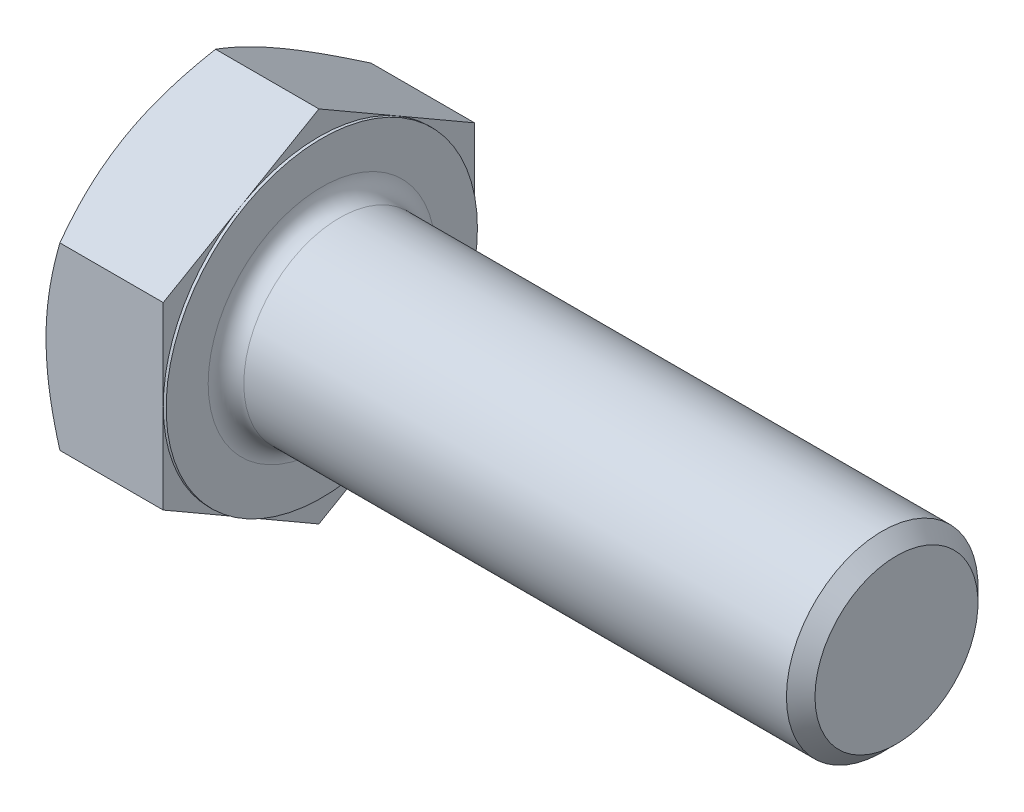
SolidWorks part; units mm, degrees
extrude "BaseHead" add sketch "Sketch1" along normal blind 15.9258
sketch "Sketch1" plane through (0, 0, 0) normal (1, 0, 0) x (0, 0, -1)
  line L0 (20.6375, 11.9151) -> (20.6375, -11.9151)
  line L1 (-20.6375, 11.9151) -> (-20.6375, -11.9151)
  line L2 (20.6375, -11.9151) -> (0, -23.8301)
  line L3 (0, -23.8301) -> (-20.6375, -11.9151)
  line L4 (20.6375, 11.9151) -> (0, 23.8301)
  line L5 (0, 23.8301) -> (-20.6375, 11.9151)
revolve "HeadChamfer" cut sketch "Sketch3" angle 360 about L6
sketch "Sketch3" plane through (0, 0, 0) normal (0, 0, 1) x (1, 0, 0)
  line L0 (0, 20.6375) -> (5.5094, 30.1801)
  line L1 (0, 23.8301) -> (0, 11.9151) construction
  line L2 (5.5094, 30.1801) -> (5.5094, 36.5301)
  line L3 (5.5094, 36.5301) -> (-12.7, 36.5301)
  line L4 (-12.7, 36.5301) -> (-12.7, 20.6375)
  line L5 (-12.7, 20.6375) -> (0, 20.6375)
  line L6 (0, 0) -> (99.06, 0) construction
  line L7 (15.9258, 23.8301) -> (0, 23.8301) construction
ref_plane "Plane1" through (0, 0, 0) normal (0, 0, 1) x (1, 0, 0)
ref_plane "Plane2" through (0, 0, 0) normal (0, 1, 0) x (1, 0, 0)
ref_plane "Plane3" through (0, 0, 0) normal (1, 0, 0) x (0, 0, -1)
sketch "BodySke" plane through (0, 0, 0) normal (0, 0, 1) x (1, 0, 0)
  line L0 (0, 11.9151) -> (0, -11.9151) construction
  line L1 (0, 0) -> (92.1258, 0)
  line L2 (0, 0) -> (0, 12.7)
  line L3 (0, 12.7) -> (90.2335, 12.7)
  line L4 (92.1258, 0) -> (92.1258, 10.8077)
  line L5 (15.9258, 23.8301) -> (15.9258, 11.9151) construction
  line L6 (92.1258, 10.8077) -> (90.2335, 12.7)
  line L7 (0, 0) -> (96.52, 0) construction
  line L8 (92.1258, -10.8077) -> (90.2335, -12.7) construction
  line L9 (0, -12.7) -> (90.2335, -12.7) construction
  line L10 (18.034, 15.24) -> (18.034, -1.27) construction
  line L11 (60.3758, 15.24) -> (60.3758, -1.27) construction
  line L12 (15.9258, 11.9151) -> (15.9258, -11.9151) construction
revolve "BaseBody" add sketch "BodySke" angle 360 about L7
sketch "Sketch4" plane through (0, 0, 0) normal (0, 0, 1) x (1, 0, 0)
  line L1 (15.9258, 23.8301) -> (15.9258, 11.9151) construction
  line L2 (15.9258, 20.6375) -> (15.5448, 20.6375)
  line L3 (15.9258, 20.6375) -> (15.9258, 49.2301)
  line L4 (15.9258, 49.2301) -> (15.5448, 49.2301)
  line L5 (0, 0) -> (95.25, 0) construction
  line L6 (0, 0) -> (96.52, 0) construction
  line L7 (15.5448, 20.6375) -> (15.5448, 49.2301)
  line L8 (15.9258, 23.8301) -> (1.8433, 23.8301) construction
revolve "BearingFace" cut sketch "Sketch4" angle 360 about L5
fillet "HeadFillet" radius 2.3622 1 edges at (15.9258, 0, -12.7)
sketch "ThdSchSke" plane through (0, 0, 0) normal (0, 0, 1) x (1, 0, 0)
  line L0 (60.3758, -10.8077) -> (59.0508, -12.7)
  line L1 (60.3758, -10.8077) -> (61.7008, -12.7)
  line L2 (61.7008, -12.7) -> (61.7008, -15.875)
  line L3 (-3.175, 0) -> (5.1513, 0) construction
  line L5 (61.7008, -15.875) -> (59.0508, -15.875)
  line L6 (59.0508, -15.875) -> (59.0508, -12.7)
revolve "ThreadSchematic" [suppressed] cut sketch "ThdSchSke" angle 360 about L3
pattern_linear "ThdSchPat" [suppressed]
equation "\"D3@Sketch1\" = \"Width_flats@Sketch1\" / 2"
equation "\"D4@Sketch1\" = \"D3@Sketch1\""
equation "\"D5@Sketch1\" = \"D4@Sketch1\""
equation "\"Thread_minor@ThreadCosmetic\" = \"Minor_dia@BodySke\""
equation "\"D1@Sketch3\" = \"Width_flats@Sketch1\" / 2"
equation "\"D1@Sketch4\" = \"Width_flats@Sketch1\" / 2"
equation "\"Thread_length@ThreadCosmetic\" = ((sgn( (\"Length@BodySke\" - \"Advance@BodySke\" ) - \"Thread_nom@BodySke\" )-1)*( (\"Length@BodySke\" - \"Advance@BodySke\" ) - \"Thread_nom@BodySke\" ))/-2+ \"Thread_nom@BodySke\""
equation "\"Thread_minor@ThdSchSke\" = \"Minor_dia@BodySke\""
equation "\"Diameter@ThdSchSke\" = \"Diameter@BodySke\""
equation "\"Overcut@ThdSchSke\" = \"Diameter@BodySke\" * 1.25"
equation "\"Start@ThdSchSke\" = \"Head_ht@BaseHead\" + \"Length@BodySke\" - \"Thread_length@ThreadCosmetic\"  '---Non-countersunk---"
equation "\"Num_threads@ThdSchPat\" = int( \"Thread_length@ThreadCosmetic\" / \"Advance@BodySke\" + 0.999 )  + 1"
equation "\"Advance@ThdSchPat\" = \"Thread_length@ThreadCosmetic\" /  (\"Num_threads@ThdSchPat\" - 1) 'relax it"
equation "\"Num_threads@ThdSchPat\" = \"Num_threads@ThdSchPat\" - sgn( \"Num_threads@ThdSchPat\" - 1) '---chamfered tips only---"
